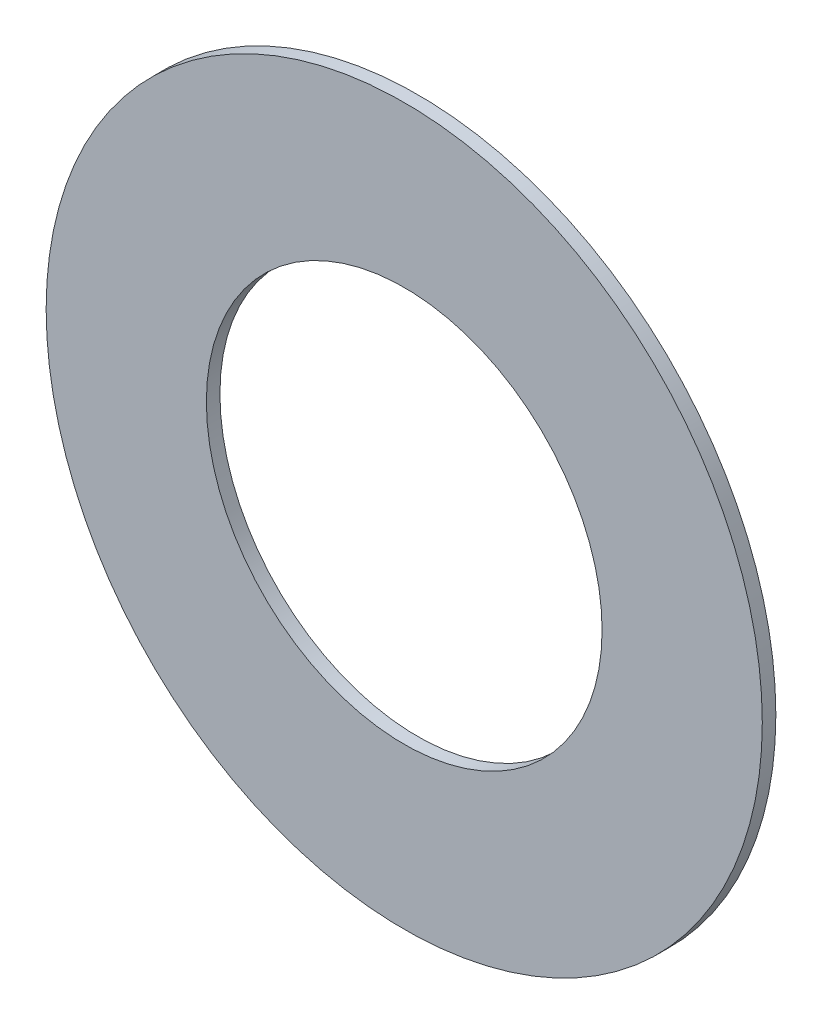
SolidWorks part; units mm, degrees
ref_plane "Front Plane" through (0, 0, 0) normal (1, 0, 0) x (0, 1, 0)
ref_plane "Top Plane" through (0, 0, 0) normal (0, 0, 1) x (0, 1, 0)
ref_plane "Right Plane" through (0, 0, 0) normal (0, 1, 0) x (-1, 0, 0)
sketch "sk 3.5in Nut" plane through (0, 0, 0) normal (0, 0, 1) x (0, 1, 0)
  point P0 (0, 0)
  line B0 (38.7698, -67.1513) -> (77.5396, 0)
  line B1 (77.5396, 0) -> (38.7698, 67.1513)
  line B2 (38.7698, 67.1513) -> (-38.7698, 67.1513)
  line B3 (-38.7698, 67.1513) -> (-77.5396, 0)
  line B4 (-77.5396, 0) -> (-38.7698, -67.1513)
  line B5 (-38.7698, -67.1513) -> (38.7698, -67.1513)
  circle B6 centre (0, 0) radius 44.45
  circle B7 centre (0, 0) radius 67.1512 construction
sketch_block_instance "Block1-1"
sketch_block "Block1"
sketch "Sketch2" plane through (0, 0, 0) normal (0, 0, 1) x (0, 1, 0)
  circle A0 centre (0, 0) radius 77.5396 construction
  circle A1 centre (0, 0) radius 83.8896
  circle A2 centre (0, 0) radius 46.355
  dimension "D2" = 92.71
  dimension "D1" = 6.35
extrude "Boss-Extrude1" add sketch "Sketch2" along normal mid plane 3.175
